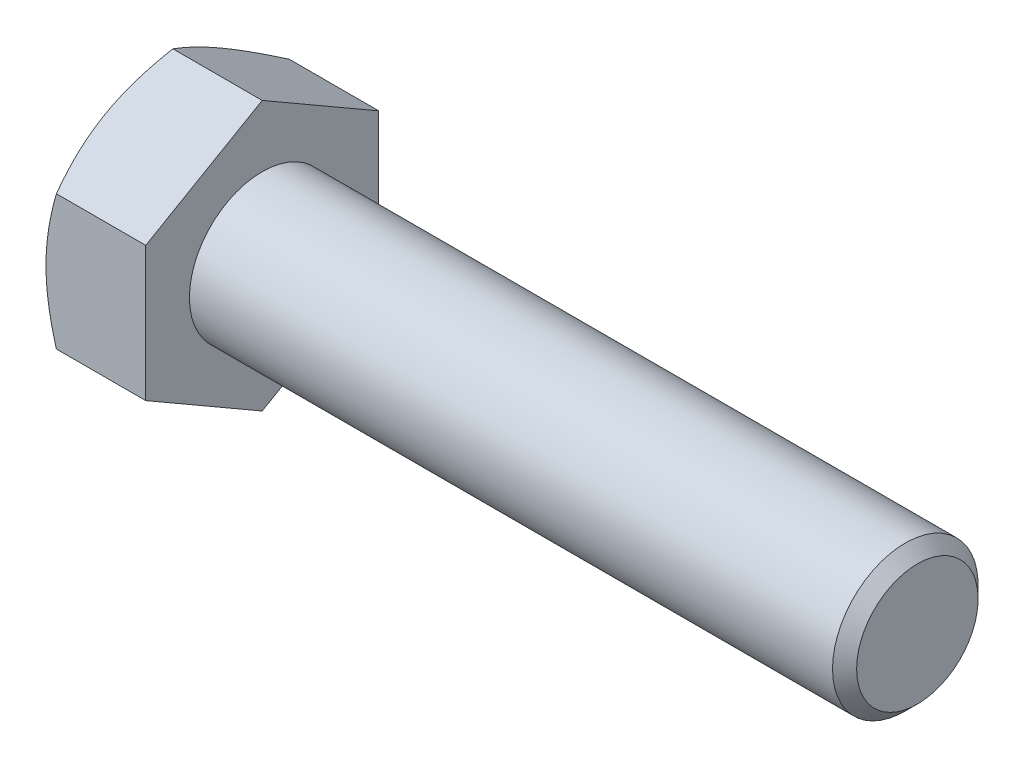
SolidWorks part; units mm, degrees
ref_plane "Plane1" through (0, 0, 0) normal (0, 0, 1) x (1, 0, 0)
ref_plane "Plane2" through (0, 0, 0) normal (0, 1, 0) x (1, 0, 0)
ref_plane "Plane3" through (0, 0, 0) normal (1, 0, 0) x (0, 0, -1)
extrude "BaseHead" add sketch "Sketch1" along normal blind 6.85
sketch "Sketch1" plane through (0, 0, 0) normal (1, 0, 0) x (0, 0, -1)
  line L0 (8, 4.6188) -> (8, -4.6188)
  line L1 (-8, 4.6188) -> (-8, -4.6188)
  line L2 (8, -4.6188) -> (0, -9.2376)
  line L3 (0, -9.2376) -> (-8, -4.6188)
  line L4 (8, 4.6188) -> (0, 9.2376)
  line L5 (0, 9.2376) -> (-8, 4.6188)
  dimension "Width_flats" = 16
  dimension "D2" = 120
  dimension "D3" = 8
  dimension "D4" = 8
  dimension "D5" = 8
revolve "BaseBody" add sketch "BodySke"
sketch "BodySke" plane through (0, 0, 0) normal (0, 0, 1) x (1, 0, 0)
  line L0 (0, 4.6188) -> (0, -4.6188) construction
  line L1 (0, 0) -> (51.85, 0)
  line L2 (0, 0) -> (0, 5)
  line L3 (0, 5) -> (51.022, 5)
  line L4 (51.85, 0) -> (51.85, 4.172)
  line L5 (6.85, 9.2376) -> (6.85, 4.6188) construction
  line L6 (51.85, 4.172) -> (51.022, 5)
  line L7 (0, 0) -> (96.52, 0) construction
  line L8 (51.85, -4.172) -> (51.022, -5) construction
  line L9 (0, -5) -> (51.022, -5) construction
  line L10 (8.35, 15.24) -> (8.35, -1.27) construction
  line L11 (6.85, 15.24) -> (6.85, -1.27) construction
  line L12 (6.85, 4.6188) -> (6.85, -4.6188) construction
  dimension "Length" = 45
  dimension "Body_ch_ang" = 45
  dimension "Diameter" = 10
  dimension "Minor_dia" = 8.344
  dimension "Advance" = 1.5
  dimension "Thread_nom" = 45
fillet "HeadFillet" [suppressed] radius 0.4
sketch "Sketch3" plane through (0, 0, 0) normal (0, 0, 1) x (1, 0, 0)
  line L0 (0, 8) -> (3.6013, 14.2376)
  line L1 (0, 9.2376) -> (0, 4.6188) construction
  line L2 (3.6013, 14.2376) -> (3.6013, 19.2376)
  line L3 (3.6013, 19.2376) -> (-10, 19.2376)
  line L4 (-10, 19.2376) -> (-10, 8)
  line L5 (-10, 8) -> (0, 8)
  line L6 (0, 0) -> (99.06, 0) construction
  line L7 (6.85, 9.2376) -> (0, 9.2376) construction
  dimension "D1" = 8
  dimension "D2" = 5
  dimension "D3" = 10
  dimension "D4" = 5
  dimension "Head_ch_ang" = 30
revolve "HeadChamfer" cut sketch "Sketch3" angle 360 about L6
sketch "ThdSchSke" plane through (0, 0, 0) normal (0, 0, 1) x (1, 0, 0)
  line L0 (8.35, -4.172) -> (7.7702, -5)
  line L1 (8.35, -4.172) -> (8.9298, -5)
  line L2 (8.9298, -5) -> (8.9298, -6.25)
  line L3 (-3.175, 0) -> (5.1513, 0) construction
  line L5 (8.9298, -6.25) -> (7.7702, -6.25)
  line L6 (7.7702, -6.25) -> (7.7702, -5)
  dimension "Thread_minor" = 8.344
  dimension "Diameter" = 10
  dimension "Start" = 8.35
  dimension "SideAngle" = 55
  dimension "VeeAngle" = 70
  dimension "Overcut" = 12.5
revolve "ThreadSchematic" [suppressed] cut sketch "ThdSchSke" angle 360 about L3
pattern_linear "ThdSchPat" [suppressed]
equation "\"D3@Sketch1\" = \"Width_flats@Sketch1\" / 2"
equation "\"D4@Sketch1\" = \"D3@Sketch1\""
equation "\"D5@Sketch1\" = \"D4@Sketch1\""
equation "\"Thread_minor@ThreadCosmetic\" = \"Minor_dia@BodySke\""
equation "\"D1@Sketch3\" = \"Width_flats@Sketch1\" / 2"
equation "' \"D1@Sketch4\" = \"Width_flats@Sketch1\""
equation "\"Thread_length@ThreadCosmetic\" = ((sgn( (\"Length@BodySke\" - \"Advance@BodySke\" ) - \"Thread_nom@BodySke\" )-1)*( (\"Length@BodySke\" - \"Advance@BodySke\" ) - \"Thread_nom@BodySke\" ))/-2+ \"Thread_nom@BodySke\""
equation "\"Thread_minor@ThdSchSke\" = \"Minor_dia@BodySke\""
equation "\"Diameter@ThdSchSke\" = \"Diameter@BodySke\""
equation "\"Overcut@ThdSchSke\" = \"Diameter@BodySke\" * 1.25"
equation "\"Start@ThdSchSke\" = \"Head_ht@BaseHead\" + \"Length@BodySke\" - \"Thread_length@ThreadCosmetic\"  '---Non-countersunk---"
equation "\"Num_threads@ThdSchPat\" = int( \"Thread_length@ThreadCosmetic\" / \"Advance@BodySke\" + 0.999 )  + 1"
equation "\"Advance@ThdSchPat\" = \"Thread_length@ThreadCosmetic\" /  (\"Num_threads@ThdSchPat\" - 1) 'relax it"
equation "\"Num_threads@ThdSchPat\" = \"Num_threads@ThdSchPat\" - sgn( \"Num_threads@ThdSchPat\" - 1) '---chamfered tips only---"
